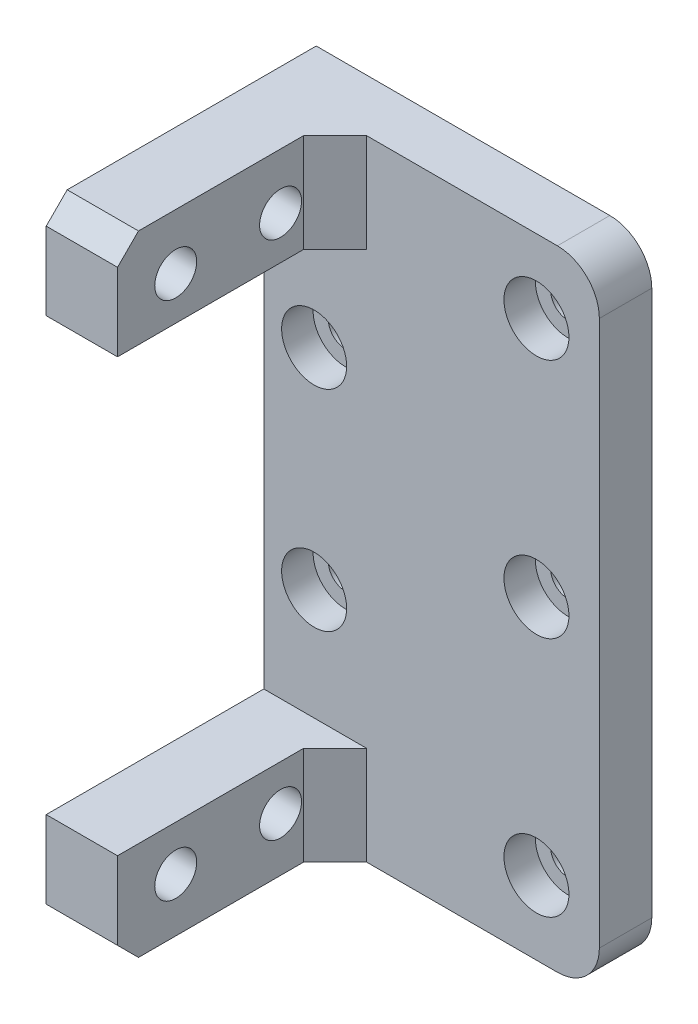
SolidWorks part; units mm, degrees
ref_plane "Спереди" through (0, 0, 0) normal (0, 0, 1) x (1, 0, 0)
ref_plane "Сверху" through (0, 0, 0) normal (0, 1, 0) x (1, 0, 0)
ref_plane "Справа" through (0, 0, 0) normal (1, 0, 0) x (0, 0, -1)
sketch "Эскиз1" plane through (0, 0, 0) normal (0, 0, 1) x (1, 0, 0)
  line L0 (-17.5, -57.25) -> (-17.5, -60) construction
  line L1 (-12.7, -60) -> (-26, -60) construction
  line L3 (-17.5, -60) -> (14.5, -60)
  line L4 (-17.5, -60) -> (-17.5, 0)
  line L5 (-17.5, 0) -> (14.5, 0)
  line L6 (14.5, -60) -> (14.5, 0)
  line L7 (12.7, 0) -> (-12.7, 0) construction
  dimension "D1" = 32
extrude "Бобышка-Вытянуть1" add sketch "Эскиз1" along normal blind 5
sketch "Эскиз2" plane through (0, 0, 5) normal (0, 0, 1) x (1, 0, 0)
  line L1 (-17.5, 0) -> (-10.7, 0)
  line L2 (-17.5, 0) -> (-17.5, -9.4)
  line L3 (-17.5, -9.4) -> (-10.7, -9.4)
  line L4 (-10.7, 0) -> (-10.7, -9.4)
  line L5 (-17.5, -60) -> (-10.7, -60)
  line L6 (-17.5, -60) -> (-17.5, -50.6)
  line L7 (-17.5, -50.6) -> (-10.7, -50.6)
  line L8 (-10.7, -60) -> (-10.7, -50.6)
  dimension "D1" = 9.4
  dimension "D2" = 6.8
extrude "Бобышка-Вытянуть2" add sketch "Эскиз2" along normal up to surface (19.55 mm away)
sketch "Эскиз3" plane through (-17.5, 0, 0) normal (-1, 0, 0) x (0, 0, 1)
  circle A0 centre (10.2, -54.9) radius 2
  circle A1 centre (20.2, -54.9) radius 2
  circle A2 centre (20.2, -5.3) radius 2
  circle A3 centre (10.2, -5.3) radius 2
  dimension "D1" = 4
extrude "Вырез-Вытянуть1" cut sketch "Эскиз3" against normal up to surface (6.8 mm away)
sketch "Эскиз4" plane through (0, 0, 5) normal (0, 0, 1) x (1, 0, 0)
  line L0 (-12.7, 0) -> (-12.7, -60) construction
  line L1 (8.5, -7) -> (8.5, 0) construction
  line L2 (14.5, 0) -> (-10.7, 0) construction
  line L3 (8.5, -7) -> (8.5, -53) construction
  line L4 (8.5, -53) -> (8.5, -60) construction
  line L5 (12.7, -60) -> (-12.7, -60) construction
  line L7 (14.5, -60) -> (14.5, 0) construction
  line L8 (-12.7, -20) -> (-12.7, 0) construction
  line L9 (-12.7, -40) -> (-12.7, -60) construction
  circle A0 centre (-12.7, -20) radius 1.65
  circle A1 centre (-12.7, -40) radius 1.65
  circle A2 centre (8.5, -7) radius 1.65
  circle A3 centre (8.5, -53) radius 1.65
  circle A4 centre (8.5, -30) radius 1.65
  dimension "D3" = 3.3
  dimension "D1" = 6
  dimension "D2" = 20
  dimension "D4" = 7
extrude "Вырез-Вытянуть2" cut sketch "Эскиз4" against normal up to vertex (5 mm away)
fillet "Скругление1" radius 4 2 edges at (14.5, 0, 2.5) (14.5, -60, 2.5)
sketch "Эскиз6" plane through (0, 0, 5) normal (0, 0, 1) x (1, 0, 0)
  circle A0 centre (-12.7, -20) radius 3.1
  circle A1 centre (8.5, -7) radius 3.1
  circle A2 centre (8.5, -30) radius 3.1
  circle A3 centre (-12.7, -40) radius 3.1
  circle A4 centre (8.5, -53) radius 3.1
  dimension "D1" = 6.2
extrude "Вырез-Вытянуть4" cut sketch "Эскиз6" against normal blind 3
sketch "Эскиз7" plane through (0, 0, 24.55) normal (0, 0, 1) x (1, 0, 0)
  line L0 (-17.5, -9.4) -> (-10.7, -9.4) construction
  line L1 (-10.7, -9.4) -> (-10.7, 0) construction
  line L2 (-10.7, 0) -> (-17.5, 0) construction
  line L3 (-17.5, 0) -> (-17.5, -9.4) construction
  line L4 (-17.5, -60) -> (-10.7, -60) construction
  line L5 (-10.7, -60) -> (-10.7, -50.6) construction
  line L6 (-10.7, -50.6) -> (-17.5, -50.6) construction
  line L7 (-17.5, -50.6) -> (-17.5, -60) construction
  line L8 (-17.5, -9.4) -> (-10.7, -9.4)
  line L9 (-10.7, -9.4) -> (-10.7, 0)
  line L10 (-10.7, 0) -> (-17.5, 0)
  line L11 (-17.5, 0) -> (-17.5, -9.4)
  line L12 (-17.5, -60) -> (-10.7, -60)
  line L13 (-10.7, -60) -> (-10.7, -50.6)
  line L14 (-10.7, -50.6) -> (-17.5, -50.6)
  line L15 (-17.5, -50.6) -> (-17.5, -60)
extrude "Бобышка-Вытянуть3" add sketch "Эскиз7" along normal blind 1.2
sketch "Эскиз8" plane through (-17.5, 0, 0) normal (-1, 0, 0) x (0, 0, 1)
  line L0 (5, -50.6) -> (0, -50.6) construction
  line L1 (25.75, -60) -> (30.75, -60)
  line L2 (25.75, -60) -> (25.75, 0)
  line L3 (25.75, 0) -> (30.75, 0)
  line L4 (30.75, -60) -> (30.75, 0)
  line L5 (0, 0) -> (0, -60) construction
extrude "Бобышка-Вытянуть4" add sketch "Эскиз8" against normal up to surface (6.8 mm away)
chamfer "Фаска2" distance 3 angle 45 2 edges at (-14.1, 0, 30.75) (-14.1, -60, 30.75)
sketch "Эскиз9" plane through (-17.5, 0, 0) normal (-1, 0, 0) x (0, 0, 1)
  line L0 (25.75, -50.6) -> (25.75, -60) construction
  line L1 (27.75, -60) -> (0, -60) construction
  line L3 (25.75, -60) -> (39.275, -60)
  line L4 (25.75, -60) -> (25.75, 0.9297)
  line L5 (25.75, 0.9297) -> (39.275, 0.9297)
  line L6 (39.275, -60) -> (39.275, 0.9297)
extrude "Вырез-Вытянуть5" cut sketch "Эскиз9" against normal blind 10
chamfer "Фаска3" distance 2 angle 45 2 edges at (-14.1, 0, 25.75) (-14.1, -60, 25.75)
chamfer "Фаска4" distance 3 angle 45 2 edges at (-10.7, -55.3, 5) (-10.7, -4.7, 5)
